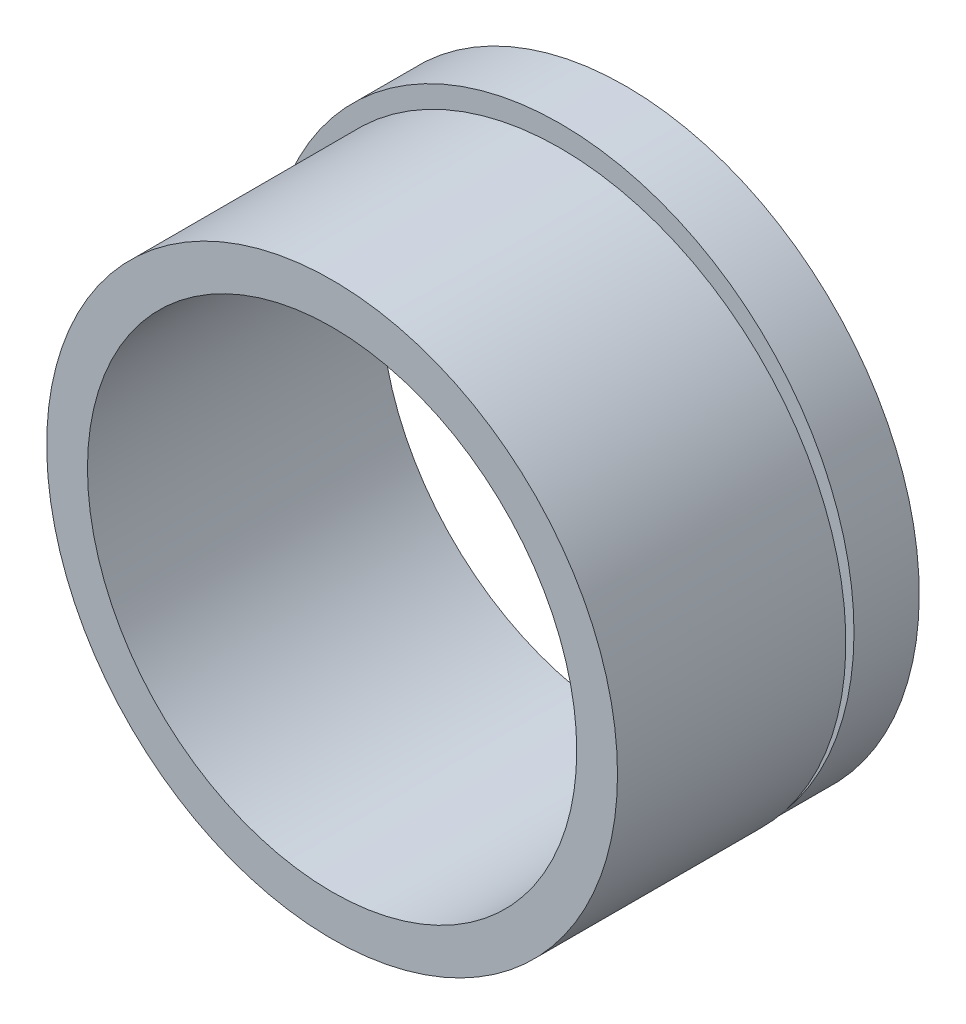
SolidWorks part; units mm, degrees
ref_plane "Plan1" through (0, 0, 0) normal (0, 0, 1) x (1, 0, 0)
ref_plane "Plan2" through (0, 0, 0) normal (0, 1, 0) x (1, 0, 0)
ref_plane "Plan3" through (0, 0, 0) normal (1, 0, 0) x (0, 0, -1)
sketch "Esquisse1" plane through (0, 0, 0) normal (0, 0, 1) x (1, 0, 0)
  circle A0 centre (0, 0) radius 17.5
  circle A1 centre (0, 0) radius 15
  dimension "D1" = 30
  dimension "D2" = 35
extrude "Base-Extrusion" add sketch "Esquisse1" along normal blind 14
sketch "Esquisse2" plane through (0, 0, 0) normal (0, 0, -1) x (-1, 0, 0)
  circle A0 centre (0, 0) radius 15 construction
  circle A1 centre (0, 0) radius 15
  circle A2 centre (0, 0.8) radius 18
  dimension "D1" = 36
  dimension "D2" = 0.8
extrude "Boss.-Extru.1" add sketch "Esquisse2" along normal blind 4
